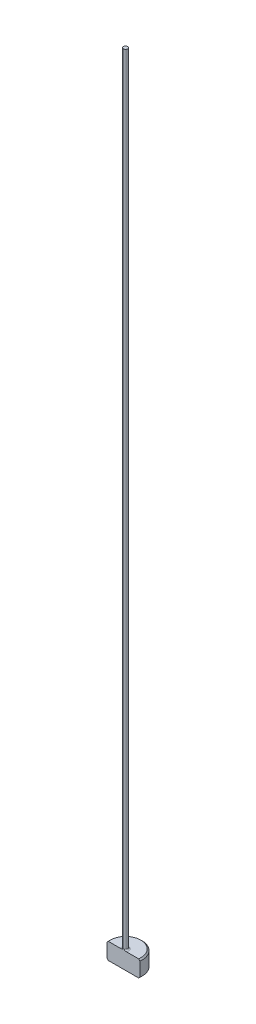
SolidWorks part; units mm, degrees
ref_plane "Front Plane" through (0, 0, 0) normal (0, 0, 1) x (1, 0, 0)
ref_plane "Top Plane" through (0, 0, 0) normal (0, 1, 0) x (1, 0, 0)
ref_plane "Right Plane" through (0, 0, 0) normal (1, 0, 0) x (0, 0, -1)
sketch "Sketch1" plane through (0, 0, 0) normal (0, 0, 1) x (1, 0, 0)
  line L0 (0, 259.9588) -> (0, -15.1925) construction
  line L1 (0, 0) -> (-3.175, 0)
  line L2 (-3.175, 0) -> (-3.175, 3.175)
  line L3 (-3.175, 3.175) -> (-0.3962, 3.175)
  line L4 (-0.3962, 3.175) -> (-0.3962, 152.4)
  line L5 (-0.3962, 152.4) -> (0, 152.4)
  line L6 (0, 152.4) -> (0, 0)
  dimension "L" = 152.4
  dimension "H" = 6.35
  dimension "T" = 3.175
  dimension "D" = 0.7925
revolve "Revolve1" add sketch "Sketch1" angle 360 about L0
chamfer "Chamfer1" distance 0.254 angle 45 2 edges at (0, 3.175, 3.175) (0, 0, 3.175)
fillet "Fillet1" radius 0.254 1 edges at (0, 3.175, 0.3962)
sketch "Sketch2" plane through (0, 0, 0) normal (0, 1, 0) x (1, 0, 0)
  line L0 (-3.1502, -0.3962) -> (3.1502, -0.3962)
  circle A0 centre (0, 0) radius 3.175 construction
  arc A1 (-3.1502, -0.3962) -> (3.1502, -0.3962) centre (0, 0) ccw
  circle A3 centre (0, 0) radius 0.3962 construction
  dimension "D1" = 0
extrude "Key" cut sketch "Sketch2" along normal through all
sketch "Pocket Sketch" plane through (0, 0, 0) normal (0, 0, 1) x (1, 0, 0)
  line L0 (-3.5719, 0) -> (-3.5719, 3.2004)
  line L1 (-3.5719, 3.2004) -> (-1.3567, 3.2004)
  line L2 (-0.5947, 3.9624) -> (-0.5947, 22.225)
  line L3 (-0.5947, 22.225) -> (0, 22.225)
  line L4 (0, 22.225) -> (0, 0)
  line L5 (0, 0) -> (-3.5719, 0)
  line L6 (0, 12.6104) -> (0, -2.4989) construction
  line L7 (-3.175, 2.921) -> (-3.175, 0.254) construction
  line L8 (2.921, 3.175) -> (-2.921, 3.175) construction
  line L9 (-0.3962, 152.4) -> (-0.3962, 3.429) construction
  line L10 (-1.3567, 3.2004) -> (-0.5947, 3.9624)
  point P3 (-0.5947, 3.2004)
  dimension "D1" = 7.1437
  dimension "D2" = 0.3969
  dimension "D3" = 0.0254
  dimension "D4" = 0.1984
  dimension "D5" = 1.1894
  dimension "D6" = 22.225
